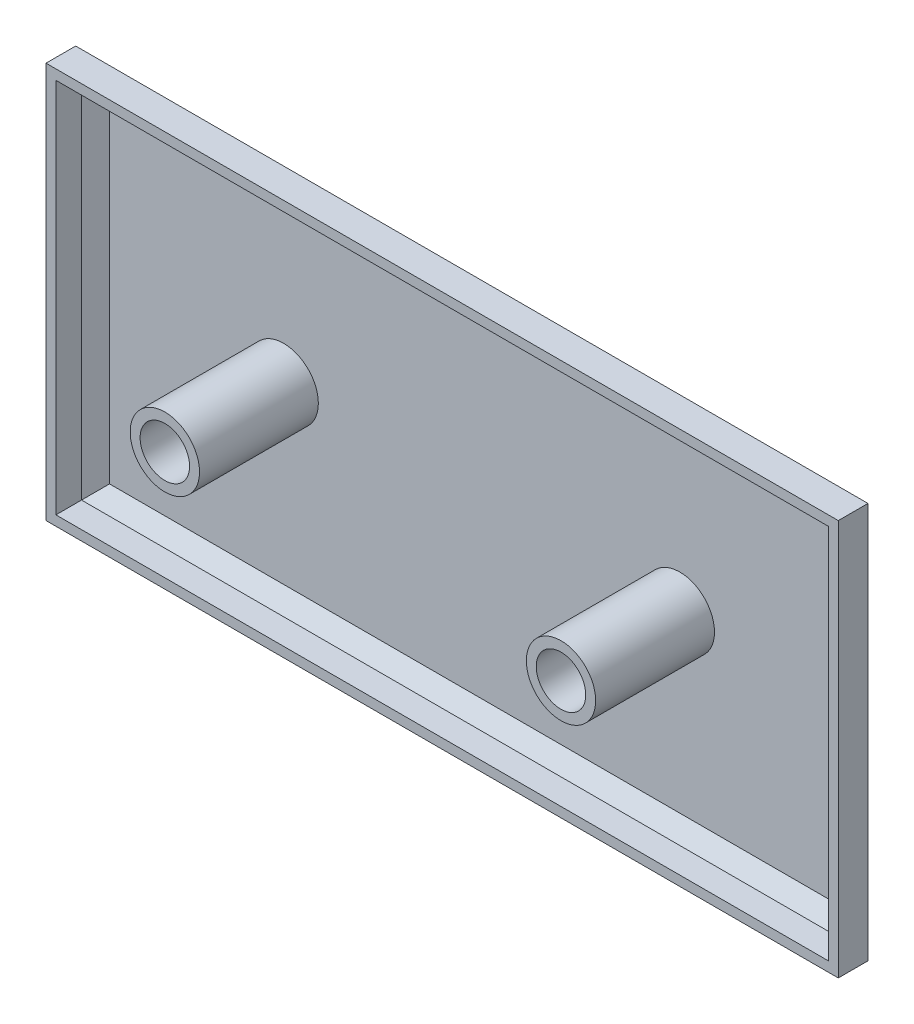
SolidWorks part; units mm, degrees
ref_plane "前视基准面" through (0, 0, 0) normal (0, 0, 1) x (1, 0, 0)
ref_plane "上视基准面" through (0, 0, 0) normal (0, 1, 0) x (1, 0, 0)
ref_plane "右视基准面" through (0, 0, 0) normal (1, 0, 0) x (0, 0, -1)
sketch "草图1" plane through (0, 0, 0) normal (0, 0, 1) x (1, 0, 0)
  line L1 (-40, 20) -> (40, 20)
  line L2 (-40, 20) -> (-40, -20)
  line L3 (-40, -20) -> (40, -20)
  line L4 (40, 20) -> (40, -20)
  dimension "D1" = 80
  dimension "D2" = 40
  dimension "D3" = 40
extrude "凸台-拉伸1" add sketch "草图1" along normal mid plane 5
chamfer "倒角1" distance 2 angle 45 4 edges at (-40, 0, -2.5) (0, 20, -2.5) (40, 0, -2.5) (0, -20, -2.5)
shell "抽壳1" thickness 1
sketch "草图2" plane through (0, 0, -1.5) normal (0, 0, 1) x (1, 0, 0)
  line L0 (-40, 20) -> (-40, -20) construction
  circle A0 centre (-20, 0) radius 3.5
  circle A1 centre (20, 0) radius 3.5
  circle A2 centre (-20, 0) radius 2.5
  circle A3 centre (20, 0) radius 2.5
  dimension "D1" = 7
  dimension "D2" = 7
  dimension "D3" = 20
  dimension "D4" = 40
extrude "凸台-拉伸2" add sketch "草图2" along normal blind 12
